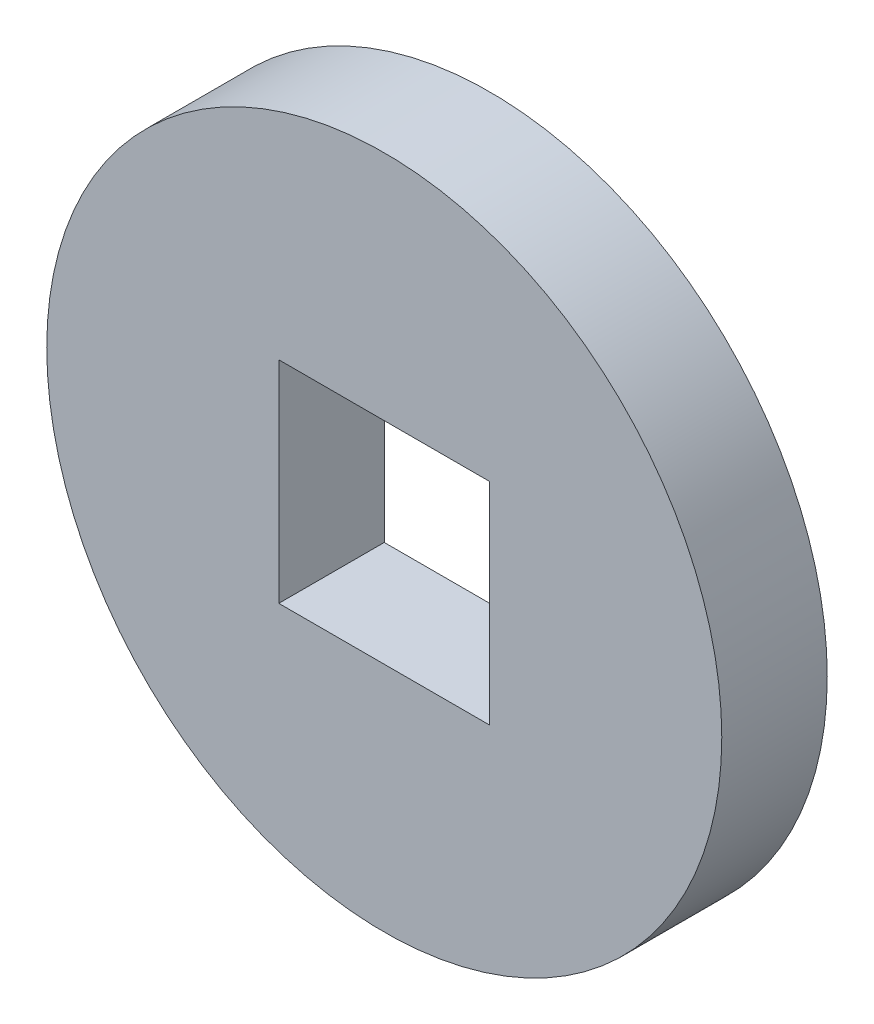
SolidWorks part; units mm, degrees
ref_plane "Front Plane" through (0, 0, 0) normal (0, 0, 1) x (1, 0, 0)
ref_plane "Top Plane" through (0, 0, 0) normal (0, 1, 0) x (1, 0, 0)
ref_plane "Right Plane" through (0, 0, 0) normal (1, 0, 0) x (0, 0, -1)
sketch "Sketch1" plane through (0, 0, 0) normal (0, 0, 1) x (1, 0, 0)
  line L1 (-3.175, 3.175) -> (3.175, 3.175)
  line L2 (-3.175, 3.175) -> (-3.175, -3.175)
  line L3 (-3.175, -3.175) -> (3.175, -3.175)
  line L4 (3.175, 3.175) -> (3.175, -3.175)
  line L5 (-3.175, 3.175) -> (3.175, -3.175) construction
  line L6 (-3.175, -3.175) -> (3.175, 3.175) construction
  circle A0 centre (0, 0) radius 10.16
  dimension "D1" = 20.32
  dimension "D2" = 6.35
  dimension "D3" = 6.35
extrude "Boss-Extrude3" add sketch "Sketch1" along normal blind 3.175
